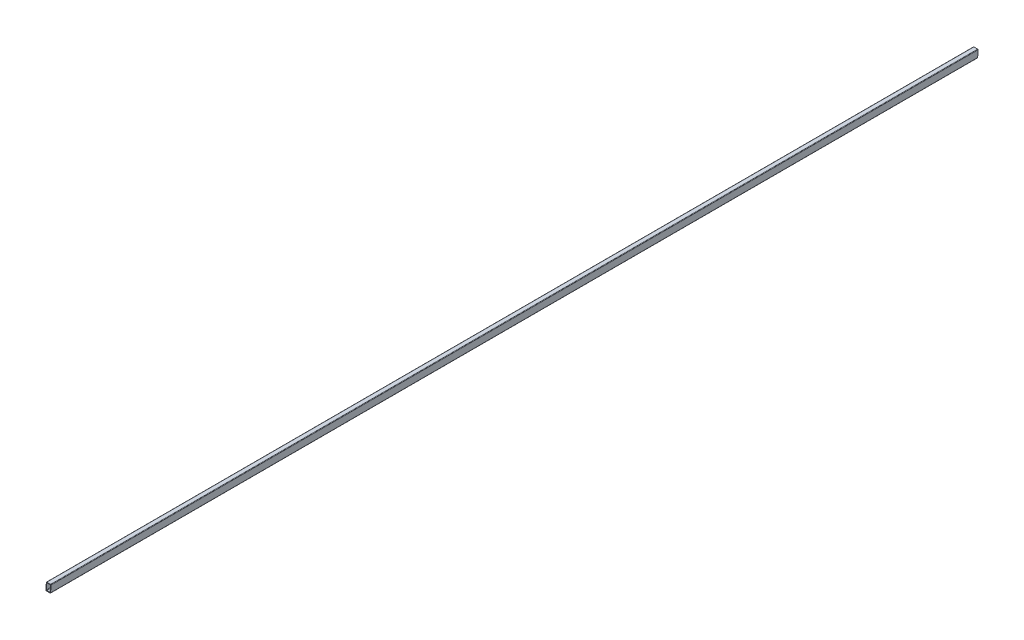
SolidWorks part; units mm, degrees
other "Objet de détail1"
ref_plane "Plan de face" through (0, 0, 0) normal (0, 0, 1) x (1, 0, 0)
ref_plane "Plan de dessus" through (0, 0, 0) normal (0, 1, 0) x (1, 0, 0)
ref_plane "Plan de droite" through (0, 0, 0) normal (1, 0, 0) x (0, 0, -1)
sketch "Esquisse1" plane through (0, 0, 0) normal (0, 0, 1) x (1, 0, 0)
  line L1 (-20, 35) -> (20, 35)
  line L2 (-20, 35) -> (-20, -35)
  line L3 (-20, -35) -> (20, -35)
  line L4 (20, 35) -> (20, -35)
  line L5 (-25, 40) -> (25, 40)
  line L6 (-25, 40) -> (-25, -40)
  line L7 (-25, -40) -> (25, -40)
  line L8 (25, 40) -> (25, -40)
  dimension "D1" = 50
  dimension "D2" = 80
  dimension "D3" = 40
  dimension "D4" = 25
  dimension "D5" = 5
  dimension "D6" = 5
  dimension "D7" = 5
  dimension "D8" = 5
extrude "Boss.-Extru.1" add sketch "Esquisse1" along normal blind 10200
sketch "Esquisse2" plane through (25, 0, 0) normal (1, 0, 0) x (0, 0, -1)
  line L0 (0, 40) -> (-5.3959, -67.919)
  line L1 (0, -40) -> (0, 40) construction
  line L2 (0, 40) -> (74.9616, 49.1635)
  line L3 (74.9616, 49.1635) -> (70.3028, -76.6252)
  line L4 (70.3028, -76.6252) -> (-5.3959, -67.919)
  dimension "D1" = 2.862
extrude "Enlèv. mat.-Extru.1" cut sketch "Esquisse2" against normal through all
fillet "Congé1" radius 5 8 edges at (-20, -35, 5101.875) (20, 35, 5100.125) (-20, 35, 5100.125) (20, -35, 5101.875) (25, -40, 5102) (-25, -40, 5102) (-25, 40, 5100) (25, 40, 5100)
sketch "Esquisse3" plane through (25, 0, 0) normal (1, 0, 0) x (0, 0, -1)
  line L0 (-10012.49, 2255.2156) -> (-10012.49, -870.9261) construction
  line L1 (-10012.49, 40) -> (-10017.8166, -66.5322)
  line L2 (-10200, 40) -> (0, 40) construction
  line L3 (-10017.8166, -66.5322) -> (-10226.996, -66.5322)
  line L4 (-10226.996, -66.5322) -> (-10226.996, 77.7331)
  line L5 (-10226.996, 77.7331) -> (-10012.49, 77.7331)
  line L6 (-10012.49, 77.7331) -> (-10012.49, 40)
  dimension "D1" = 10012.49
  dimension "D2" = 2.862
extrude "Enlèv. mat.-Extru.2" cut sketch "Esquisse3" against normal through all
